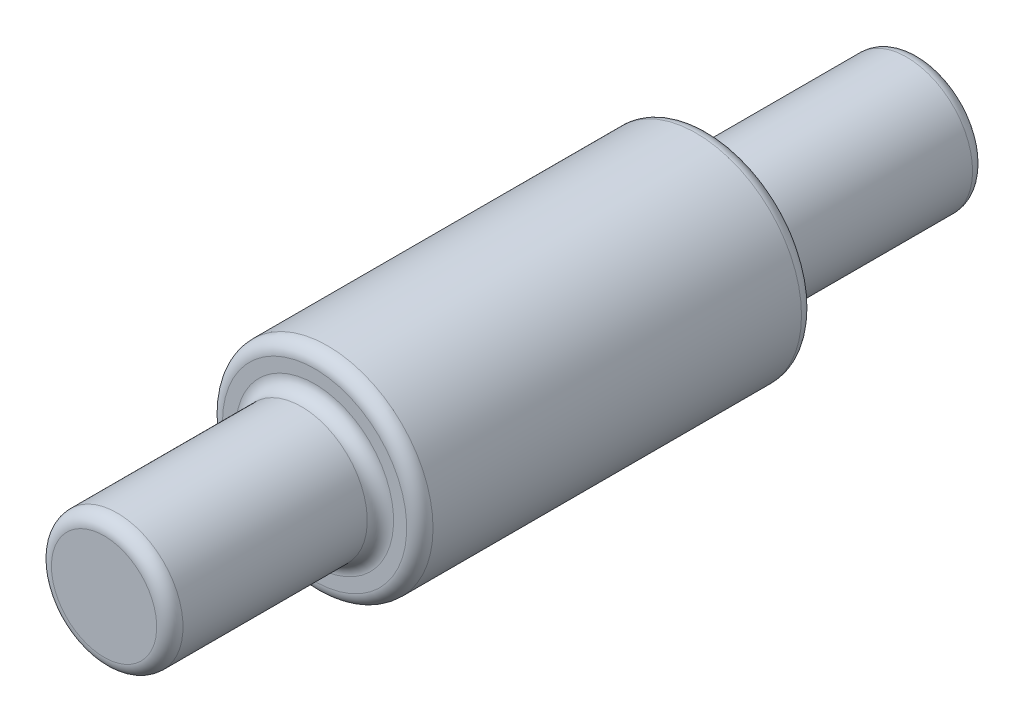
SolidWorks part; units mm, degrees
ref_plane "Спереди" through (0, 0, 0) normal (0, 0, 1) x (1, 0, 0)
ref_plane "Сверху" through (0, 0, 0) normal (0, 1, 0) x (1, 0, 0)
ref_plane "Справа" through (0, 0, 0) normal (1, 0, 0) x (0, 0, -1)
sketch "Эскиз1" plane through (0, 0, 0) normal (1, 0, 0) x (0, 0, -1)
  line L0 (-15.5, 0) -> (15.5, 0)
  line L1 (15.5, 0) -> (15.5, 2.5)
  line L2 (15.5, 2.5) -> (7.5, 2.5)
  line L3 (7.5, 2.5) -> (7.5, 4)
  line L4 (7.5, 4) -> (-7.5, 4)
  line L5 (-7.5, 4) -> (-7.5, 2.5)
  line L6 (-7.5, 2.5) -> (-15.5, 2.5)
  line L7 (-15.5, 2.5) -> (-15.5, 0)
  dimension "D1" = 15
  dimension "D2" = 4
  dimension "D3" = 2.5
  dimension "D4" = 8
revolve "Повернуть1" add sketch "Эскиз1" angle 360 about L0
fillet "Скругление1" radius 0.5 6 edges at (2.5, 0, -15.5) (2.5, 0, -7.5) (2.5, 0, 7.5) (2.5, 0, 15.5) (4, 0, -7.5) (4, 0, 7.5)
